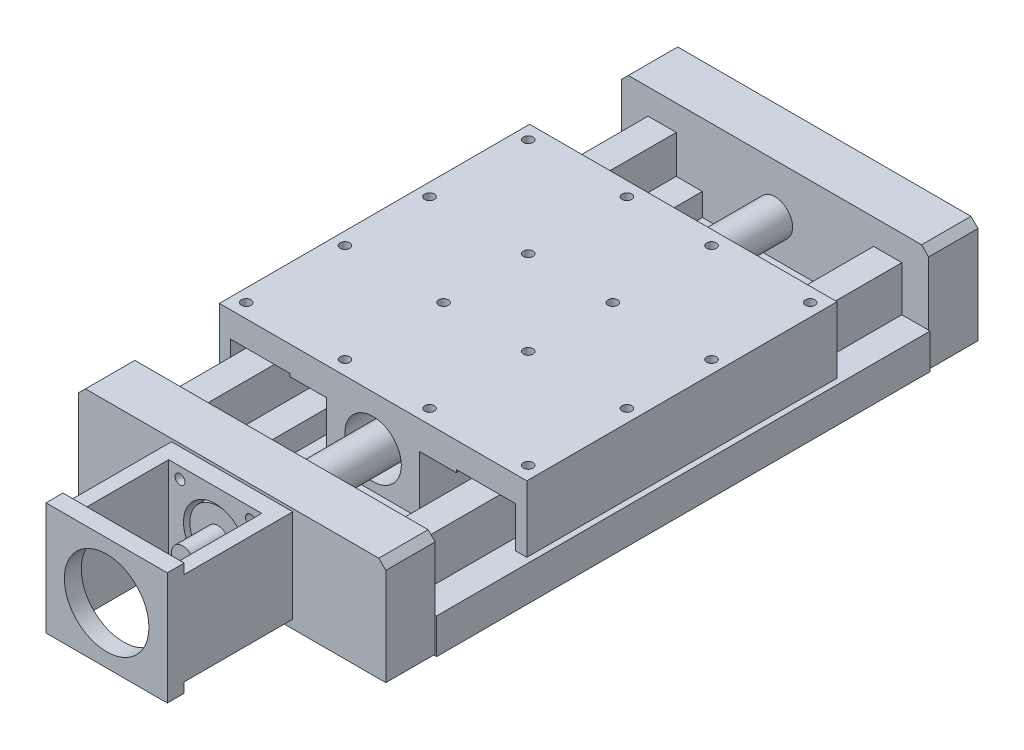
SolidWorks part; units mm, degrees
ref_plane "前视基准面" through (0, 0, 0) normal (0, 0, 1) x (1, 0, 0)
ref_plane "上视基准面" through (0, 0, 0) normal (0, 1, 0) x (1, 0, 0)
ref_plane "右视基准面" through (0, 0, 0) normal (1, 0, 0) x (0, 0, -1)
sketch "草图1" plane through (0, 0, 0) normal (0, 0, 1) x (1, 0, 0)
  line L0 (51.5, 0) -> (-51.5, 0)
  line L1 (-51.5, 0) -> (-51.5, 16)
  line L2 (-51.5, 16) -> (-70, 16)
  line L3 (-70, 16) -> (-70, 13)
  line L4 (-70, 13) -> (-90, 13)
  line L5 (-90, 13) -> (-90, 11)
  line L6 (-90, 11) -> (-110, 11)
  line L7 (-110, 11) -> (-110, -14)
  line L8 (-110, -14) -> (110, -14)
  line L9 (0, -14) -> (0, 0) construction
  line L10 (110, 11) -> (110, -14)
  line L11 (90, 11) -> (110, 11)
  line L12 (90, 13) -> (90, 11)
  line L13 (70, 13) -> (90, 13)
  line L14 (70, 16) -> (70, 13)
  line L15 (51.5, 16) -> (70, 16)
  line L16 (51.5, 0) -> (51.5, 16)
  dimension "D1" = 51.5
  dimension "D2" = 30
  dimension "D3" = 27
  dimension "D4" = 25
  dimension "D5" = 70
  dimension "D6" = 90
  dimension "D7" = 110
  dimension "D8" = 14
extrude "凸台-拉伸1" add sketch "草图1" along normal blind 350
sketch "草图2" plane through (0, 0, 350) normal (0, 0, 1) x (1, 0, 0)
  line L0 (-110, -14) -> (110, -14) construction
  line L1 (-70, -14) -> (70, -14)
  line L2 (-70, -14) -> (-70, -13)
  line L3 (-70, -13) -> (70, -13)
  line L4 (70, -14) -> (70, -13)
  line L5 (0, 0) -> (0, -14) construction
  dimension "D1" = 140
  dimension "D2" = 1
extrude "切除-拉伸1" cut sketch "草图2" against normal through all
ref_plane "基准面1" through (0, 0, 175) normal (0, 0, 1) x (1, 0, 0)
sketch "草图4" plane through (0, 13, 0) normal (0, 1, 0) x (1, 0, 0)
  line L0 (0, 0) -> (0, -350) construction
  line L1 (-90, 0) -> (-70, 0)
  line L2 (-90, 0) -> (-90, -350)
  line L3 (-90, -350) -> (-70, -350)
  line L4 (-70, 0) -> (-70, -350)
  line L5 (51.5, -350) -> (-51.5, -350) construction
  line L6 (70, 0) -> (70, -350)
  line L7 (90, -350) -> (70, -350)
  line L8 (90, 0) -> (90, -350)
  line L9 (90, 0) -> (70, 0)
extrude "凸台-拉伸2" add sketch "草图4" along normal blind 30 separate body
sketch "草图5" plane through (0, 0, 175) normal (0, 0, 1) x (1, 0, 0)
  line L0 (-70, 43) -> (70, 43) construction
  line L1 (0, 43) -> (0, 0) construction
  line L2 (-80, 43) -> (-80, 61) construction
  line L3 (-90, 43) -> (-70, 43) construction
  line L4 (-80, 61) -> (80, 61)
  line L5 (0, 61) -> (0, 43) construction
  line L6 (-80, 61) -> (-109, 61)
  line L7 (-109, 61) -> (-109, 14)
  line L8 (-109, 14) -> (-101, 14)
  line L9 (-101, 14) -> (-101, 43)
  line L10 (-101, 43) -> (-90, 43)
  line L11 (-59, 43) -> (-59, 41)
  line L12 (-59, 41) -> (-33, 41)
  line L13 (-33, 41) -> (-33, 43)
  line L14 (-33, 43) -> (33, 43)
  line L15 (-59, 43) -> (-70, 43)
  line L16 (-70, 43) -> (-90, 43)
  line L17 (80, 43) -> (80, 61) construction
  line L18 (70, 43) -> (90, 43)
  line L19 (59, 43) -> (70, 43)
  line L20 (33, 41) -> (33, 43)
  line L21 (59, 41) -> (33, 41)
  line L22 (59, 43) -> (59, 41)
  line L23 (101, 43) -> (90, 43)
  line L24 (101, 14) -> (101, 43)
  line L25 (109, 14) -> (101, 14)
  line L26 (109, 61) -> (109, 14)
  line L27 (80, 61) -> (109, 61)
  dimension "D1" = 109
  dimension "D2" = 42
  dimension "D3" = 21
  dimension "D4" = 20
  dimension "D5" = 47
  dimension "D6" = 18
  dimension "D7" = 33
extrude "凸台-拉伸3" add sketch "草图5" along normal mid plane 220
sketch "草图6" plane through (0, 0, 285) normal (0, 0, 1) x (1, 0, 0)
  line L0 (0, 61) -> (0, 43) construction
  line L1 (-33, 43) -> (33, 43)
  line L2 (-33, 43) -> (-33, 0)
  line L3 (-33, 0) -> (33, 0)
  line L4 (33, 43) -> (33, 0)
  line L5 (109, 61) -> (-109, 61) construction
  dimension "D1" = 61
extrude "凸台-拉伸4" add sketch "草图6" against normal blind 100
sketch "草图7" plane through (0, 0, 285) normal (0, 0, 1) x (1, 0, 0)
  line L0 (0, 61) -> (0, 26) construction
  line L1 (109, 61) -> (-109, 61) construction
  circle A0 centre (0, 26) radius 15
  dimension "D2" = 30
  dimension "D1" = 35
extrude "切除-拉伸2" cut sketch "草图7" against normal through all
sketch "草图8" plane through (0, 0, 285) normal (0, 0, 1) x (1, 0, 0)
  circle A0 centre (0, 26) radius 20
  dimension "D1" = 40
extrude "切除-拉伸3" cut sketch "草图8" against normal blind 65
sketch "草图9" plane through (0, 0, 350) normal (0, 0, 1) x (1, 0, 0)
  line L0 (70, -13) -> (-70, -13) construction
  line L1 (-109, 61) -> (109, 61)
  line L2 (-109, 61) -> (-109, -13)
  line L3 (-109, -13) -> (109, -13)
  line L4 (109, 61) -> (109, -13)
  line L5 (109, 14) -> (109, 61) construction
extrude "凸台-拉伸5" add sketch "草图9" along normal blind 35 separate body
mirror "镜向1" about plane through (0, 0, 175) normal (0, 0, 1)
sketch "草图10" plane through (0, 0, 0) normal (0, 0, 1) x (1, 0, 0)
  line L0 (0, 61) -> (0, 26) construction
  line L1 (109, 61) -> (-109, 61) construction
  circle A0 centre (0, 26) radius 12.5
  dimension "D2" = 25
  dimension "D1" = 35
extrude "凸台-拉伸6" add sketch "草图10" along normal up to surface (385 mm away) separate body
sketch "草图12" plane through (0, 0, 385) normal (0, 0, 1) x (1, 0, 0)
  circle A0 centre (0, 26) radius 8
  dimension "D1" = 16
extrude "凸台-拉伸7" add sketch "草图12" along normal blind 35
sketch "草图13" plane through (0, 0, 385) normal (0, 0, 1) x (1, 0, 0)
  circle A0 centre (0, 26) radius 20
  dimension "D1" = 40
extrude "凸台-拉伸8" add sketch "草图13" along normal blind 10
chamfer "倒角2" distance 5 angle 45 2 edges at (-109, 61, -17.5) (109, 61, -17.5)
chamfer "倒角3" distance 5 angle 45 2 edges at (-109, 61, 367.5) (109, 61, 367.5)
sketch "草图14" plane through (0, 11, 0) normal (0, 1, 0) x (1, 0, 0)
  line L0 (-110, 0) -> (-110, -10)
  line L1 (-110, -350) -> (-110, 0) construction
  line L2 (-110, -10) -> (-100, -20)
  line L3 (-100, -20) -> (-110, -30)
  line L4 (-100, -20) -> (-110, -20) construction
  line L5 (-110, -30) -> (-100, -40)
  line L6 (-100, -40) -> (-110, -50)
  line L7 (-110, -50) -> (-100, -60)
  line L8 (-100, -60) -> (-110, -70)
  line L9 (-110, -70) -> (-100, -80)
  line L10 (-100, -80) -> (-110, -90)
  line L11 (-110, -90) -> (-100, -100)
  line L12 (-100, -100) -> (-110, -110)
  line L13 (-110, -110) -> (-100, -120)
  line L14 (-100, -120) -> (-110, -130)
  line L15 (-110, -130) -> (-100, -140)
  line L16 (-100, -140) -> (-110, -150)
  line L17 (-110, -150) -> (-100, -160)
  line L18 (-100, -160) -> (-110, -170)
  line L19 (-110, -170) -> (-100, -180)
  line L20 (-100, -180) -> (-110, -190)
  line L21 (-110, -190) -> (-100, -200)
  line L22 (-100, -200) -> (-110, -210)
  dimension "D1" = 90
  dimension "D2" = 45
  dimension "D3" = 10
  dimension "D4" = 20
  dimension "D5" = 10
sketch "草图15" plane through (0, 0, 0) normal (0, 0, 1) x (1, 0, 0)
  line L0 (110, -14) -> (110, 11) construction
  line L1 (-110, 11) -> (110, 11) construction
  line L2 (-110, 11) -> (-110, 61)
  line L3 (-110, 61) -> (110, 61)
  line L4 (110, 11) -> (110, 61)
  line L5 (104, 61) -> (-104, 61) construction
surface "曲面-扫描1" [suppressed]
mirror "镜向2" [suppressed] about plane through (0, 0, 175) normal (0, 0, 1)
sketch "草图16" plane through (0, 0, 385) normal (0, 0, 1) x (1, 0, 0)
  line L0 (0, 26) -> (0, 59) construction
  line L1 (-43, 59) -> (43, 59)
  line L2 (-43, 59) -> (-43, -7)
  line L3 (-43, -7) -> (43, -7)
  line L4 (43, 59) -> (43, -7)
  line L5 (0, 26) -> (43, 26) construction
  line L6 (43, 26) -> (26.7624, 26) construction
  circle A0 centre (0, 26) radius 22.5
  dimension "D3" = 45
  dimension "D1" = 86
  dimension "D2" = 66
extrude "凸台-拉伸9" add sketch "草图16" along normal blind 12
sketch "草图17" plane through (0, 0, 397) normal (0, 0, 1) x (1, 0, 0)
  line L0 (-43, -7) -> (43, -7) construction
  line L1 (-43, 59) -> (-33, 59)
  line L2 (-43, 59) -> (-43, -7)
  line L3 (-43, -7) -> (-33, -7)
  line L4 (-33, 59) -> (-33, -7)
  line L5 (0, 26) -> (0, -7) construction
  line L6 (-43, -7) -> (43, -7) construction
  line L7 (33, 59) -> (33, -7)
  line L8 (43, -7) -> (33, -7)
  line L9 (43, 59) -> (43, -7)
  line L10 (43, 59) -> (33, 59)
  dimension "D1" = 10
extrude "凸台-拉伸10" add sketch "草图17" along normal blind 65
sketch "草图18" plane through (0, 0, 462) normal (0, 0, 1) x (1, 0, 0)
  line L0 (43, -7) -> (43, 59) construction
  line L1 (-43, 66) -> (43, 66)
  line L2 (-43, 66) -> (-43, -14)
  line L3 (-43, -14) -> (43, -14)
  line L4 (43, 66) -> (43, -14)
  line L5 (-43, 59) -> (-43, -7) construction
  line L6 (0, 26) -> (43, 26) construction
  circle A0 centre (0, 26) radius 30
  dimension "D2" = 60
  dimension "D1" = 80
extrude "凸台-拉伸11" add sketch "草图18" along normal blind 12
sketch "草图19" [suppressed] plane through (0, 0, 484) normal (0, 0, 1) x (1, 0, 0)
  line L1 (-43, 61) -> (43, 61)
  line L2 (-43, 61) -> (-43, -14)
  line L3 (-43, -14) -> (43, -14)
  line L4 (43, 61) -> (43, -14)
  line L6 (-43, 66) -> (-43, -14) construction
  dimension "D1" = 75
extrude "凸台-拉伸12" [suppressed] add sketch "草图19" along normal blind 118 separate body
sketch "草图20" [suppressed] plane through (0, 0, 862) normal (0, 0, 1) x (1, 0, 0)
  circle A0 centre (-43, 63.5) radius 18
  dimension "D1" = 36
extrude "切除-拉伸4" [suppressed] cut sketch "草图20" against normal blind 108
pattern_circular "阵列(圆周)1" [suppressed] count 4 over 360
sketch "草图21" [suppressed] plane through (0, 0, 744) normal (0, 0, -1) x (-1, 0, 0)
  circle A0 centre (0, 26) radius 6.35
  dimension "D1" = 12.7
extrude "凸台-拉伸13" [suppressed] add sketch "草图21" along normal blind 30 separate body
sketch "草图22" [suppressed] plane through (0, 61, 0) normal (0, 1, 0) x (1, 0, 0)
  line L0 (0, -200) -> (0, -290) construction
  line L1 (-100, -80) -> (-30, -80) construction
  line L2 (-100, -80) -> (-100, -150) construction
  line L3 (-100, -150) -> (-30, -150) construction
  line L4 (-30, -80) -> (-30, -150) construction
  line L5 (-100, -200) -> (100, -200) construction
  line L6 (109, -290) -> (-109, -290) construction
  line L7 (110, -180) -> (-110, -180) construction
  line L8 (110, -360) -> (110, 0) construction
  line L9 (-110, -360) -> (-110, 0) construction
  line L10 (30, -80) -> (30, -150) construction
  line L11 (100, -150) -> (30, -150) construction
  line L12 (100, -80) -> (100, -150) construction
  line L13 (100, -80) -> (30, -80) construction
  line L14 (100, -280) -> (30, -280) construction
  line L15 (100, -280) -> (100, -210) construction
  line L16 (100, -210) -> (30, -210) construction
  line L17 (30, -280) -> (30, -210) construction
  line L18 (-30, -280) -> (-30, -210) construction
  line L19 (-100, -210) -> (-30, -210) construction
  line L20 (-100, -280) -> (-100, -210) construction
  line L21 (-100, -280) -> (-30, -280) construction
  dimension "D1" = 70
  dimension "D2" = 70
  dimension "D3" = 30
  dimension "D4" = 30
hole_wizard "M8 螺纹孔1" positions "3D草图1" profile "草图24" tap size "M8" standard "GB"
sketch3d "3D草图1" [suppressed]
  point P0 (-100, 61, 80)
  point P3 (-30, 61, 80)
  point P6 (-100, 61, 150)
  point P9 (-30, 61, 150)
  point P12 (30, 61, 150)
  point P15 (30, 61, 80)
  point P20 (100, 61, 150)
  point P23 (100, 61, 80)
  point P26 (100, 61, 210)
  point P29 (100, 61, 280)
  point P32 (30, 61, 280)
  point P35 (30, 61, 210)
  point P38 (-30, 61, 210)
  point P41 (-30, 61, 280)
  point P44 (-100, 61, 280)
  point P47 (-100, 61, 210)
sketch "草图24" plane through (-100, 61, 80) normal (1, 0, 0) x (0, 0, 1)
  line L0 (0, 0) -> (0, 24.2929)
  line L1 (0, 24.2929) -> (3.4, 22.25)
  line L2 (3.4, 22.25) -> (3.4, 0)
  line L5 (3.4, 0) -> (0, 0)
  line L10 (0, 24.2929) -> (-3.4, 22.25) construction
  line L11 (0, -6.35) -> (0, 107.95) construction
  dimension "螺纹孔钻头直径" = 6.8
  dimension "螺纹孔钻头深度" = 22.25
  dimension "导头角度" = 118
sketch "草图25" [suppressed] plane through (0, 11, 0) normal (0, 1, 0) x (1, 0, 0)
  line L0 (-100, 0) -> (-100, -360) construction
  line L1 (110, 0) -> (-110, 0) construction
  line L3 (104, -360) -> (-104, -360) construction
  line L4 (0, 0) -> (0, -430) construction
  line L5 (104, 0) -> (-104, 0) construction
  line L6 (-8, -430) -> (8, -430) construction
  point P11 (-100, -330)
  dimension "D1" = 100
  dimension "D2" = 330
hole_wizard "打孔尺寸根据内六角圆柱头螺钉的类型1" positions "3D草图2" profile "草图26" counterbore size "M8" standard "GB"
sketch3d "3D草图2" [suppressed]
  point P0 (-100, 11, 330)
sketch "草图26" plane through (-100, 11, 330) normal (1, 0, 0) x (0, 0, 1)
  line L0 (0, 0) -> (0, 25)
  line L1 (0, 25) -> (4.5, 25)
  line L3 (4.5, 25) -> (4.5, 9)
  line L4 (4.5, 9) -> (7.5, 9)
  line L5 (7.5, 9) -> (7.5, 0)
  line L7 (7.5, 0) -> (0, 0)
  line L11 (0, -6.35) -> (0, 107.95) construction
  dimension "通孔孔直径" = 9
  dimension "通孔孔深度" = 25
  dimension "柱形沉头孔直径" = 15
  dimension "柱形沉头孔深度" = 9
pattern_linear "阵列(线性)1" [suppressed] count 3 spacing 120
ref_plane "基准面2" through (0, 0, 0) normal (-1, 0, 0) x (0, 0, 1)
mirror "镜向3" [suppressed] about plane through (0, 0, 0) normal (-1, 0, 0)
sketch "草图27" [suppressed] plane through (0, 0, 484) normal (0, 0, 1) x (1, 0, 0)
  line L1 (-43, 66) -> (43, 66)
  line L2 (-43, 66) -> (-43, -14)
  line L3 (-43, -14) -> (43, -14)
  line L4 (43, 66) -> (43, -14)
extrude "凸台-拉伸14" [suppressed] add sketch "草图27" along normal blind 127 separate body
sketch "草图28" [suppressed] plane through (0, 0, 611) normal (0, 0, 1) x (1, 0, 0)
  circle A0 centre (-43, 66) radius 20
  dimension "D1" = 40
extrude "切除-拉伸5" [suppressed] cut sketch "草图28" against normal blind 117
pattern_circular "阵列(圆周)2" [suppressed] count 4 every 90
fillet "圆角1" [suppressed] radius 3
sketch "草图29" [suppressed] plane through (0, 0, 484) normal (0, 0, -1) x (-1, 0, 0)
  circle A0 centre (0, 26) radius 9.5
  dimension "D1" = 19
extrude "凸台-拉伸15" [suppressed] add sketch "草图29" along normal blind 40 separate body
sketch "草图30" plane through (0, 0, 385) normal (0, 0, 1) x (1, 0, 0)
  line L0 (0, 26) -> (25, 26) construction
  line L1 (-25, 51) -> (25, 51) construction
  line L2 (-25, 51) -> (-25, 1) construction
  line L3 (-25, 1) -> (25, 1) construction
  line L4 (25, 51) -> (25, 1) construction
  line L5 (0, 26) -> (0, 51) construction
  dimension "D1" = 50
  dimension "D2" = 50
sketch "草图32" plane through (0, 0, 397) normal (0, 0, 1) x (1, 0, 0)
  line L0 (0, 26) -> (0, 51) construction
  line L1 (-25, 51) -> (25, 51) construction
  line L2 (-25, 51) -> (-25, 1) construction
  line L3 (-25, 1) -> (25, 1) construction
  line L4 (25, 51) -> (25, 1) construction
  line L5 (0, 26) -> (25, 26) construction
  circle A0 centre (-25, 51) radius 3.5
  circle A1 centre (25, 51) radius 3.5
  circle A2 centre (25, 1) radius 3.5
  circle A3 centre (-25, 1) radius 3.5
  dimension "D3" = 7
  dimension "D4" = 7
  dimension "D5" = 7
  dimension "D6" = 7
  dimension "D1" = 50
  dimension "D2" = 50
extrude "切除-拉伸6" cut sketch "草图32" against normal up to surface (12 mm away)
hole_wizard "M6 螺纹孔2" positions "草图34" profile "草图33" tap size "M6" standard "GB"
sketch "草图34" plane through (0, 0, 397) normal (0, 0, 1) x (1, 0, 0)
  point P1 (-25, 51)
  point P4 (25, 51)
  point P7 (-25, 1)
  point P10 (25, 1)
sketch "草图33" plane through (-25, 51, 397) normal (1, 0, 0) x (0, -1, 0)
  line L0 (0, 0) -> (0, 16.5022)
  line L1 (0, 16.5022) -> (2.5, 15)
  line L2 (2.5, 15) -> (2.5, 0)
  line L5 (2.5, 0) -> (0, 0)
  line L10 (0, 16.5022) -> (-2.5, 15) construction
  line L11 (0, -6.35) -> (0, 107.95) construction
  dimension "螺纹孔钻头直径" = 5
  dimension "螺纹孔钻头深度" = 15
  dimension "导头角度" = 118
sketch "草图35" plane through (0, 61, 0) normal (0, 1, 0) x (1, 0, 0)
  line L0 (-109, -175) -> (109, -175) construction
  line L1 (-109, -285) -> (-109, -65) construction
  line L2 (109, -285) -> (109, -65) construction
  line L3 (0, -65) -> (0, -285) construction
  line L4 (109, -65) -> (-109, -65) construction
  line L5 (109, -285) -> (-109, -285) construction
  line L6 (-100, -145) -> (-30, -145) construction
  line L7 (-30, -145) -> (-30, -75) construction
  line L8 (-30, -75) -> (-100, -75) construction
  line L9 (-100, -75) -> (-100, -145) construction
  line L10 (-100, -205) -> (-30, -205) construction
  line L11 (-30, -205) -> (-30, -275) construction
  line L12 (-30, -275) -> (-100, -275) construction
  line L13 (-100, -275) -> (-100, -205) construction
  line L14 (30, -145) -> (30, -75) construction
  line L15 (100, -75) -> (100, -145) construction
  line L16 (30, -75) -> (100, -75) construction
  line L17 (100, -145) -> (30, -145) construction
  line L18 (100, -205) -> (30, -205) construction
  line L19 (30, -205) -> (30, -275) construction
  line L20 (30, -275) -> (100, -275) construction
  line L21 (100, -275) -> (100, -205) construction
  dimension "D1" = 70
  dimension "D2" = 70
  dimension "D3" = 30
  dimension "D4" = 30
hole_wizard "M8 螺纹孔2" positions "草图37" profile "草图36" tap size "M8" standard "GB"
sketch "草图37" plane through (0, 61, 0) normal (0, 1, 0) x (-1, 0, 0)
  point P0 (100, 75)
  point P1 (100, 275)
  point P3 (100, 205)
  point P6 (30, 205)
  point P9 (30, 275)
  point P12 (-30, 275)
  point P15 (-30, 205)
  point P18 (-100, 205)
  point P21 (-100, 275)
  point P24 (-30, 145)
  point P27 (-30, 75)
  point P30 (-100, 75)
  point P33 (-100, 145)
  point P36 (30, 75)
  point P39 (30, 145)
  point P42 (100, 145)
sketch "草图36" plane through (-100, 61, 75) normal (1, 0, 0) x (0, 0, 1)
  line L0 (0, 0) -> (0, 24.2929)
  line L1 (0, 24.2929) -> (3.4, 22.25)
  line L2 (3.4, 22.25) -> (3.4, 0)
  line L5 (3.4, 0) -> (0, 0)
  line L10 (0, 24.2929) -> (-3.4, 22.25) construction
  line L11 (0, -6.35) -> (0, 107.95) construction
  dimension "螺纹孔钻头直径" = 6.8
  dimension "螺纹孔钻头深度" = 22.25
  dimension "导头角度" = 118
